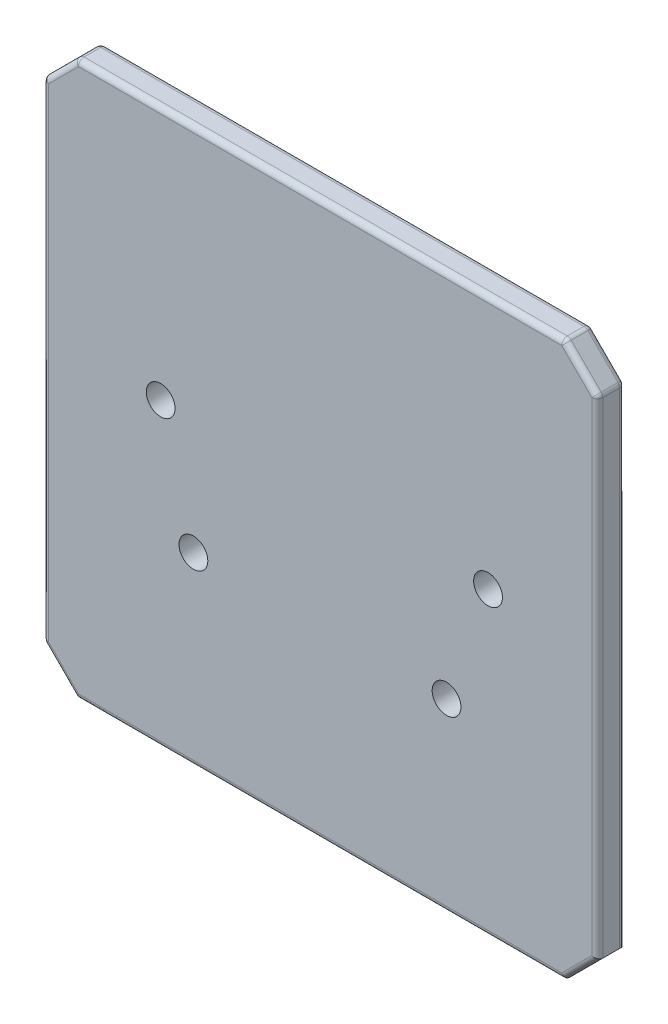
SolidWorks part; units mm, degrees
ref_plane "Front Plane" through (0, 0, 0) normal (0, 0, 1) x (1, 0, 0)
ref_plane "Top Plane" through (0, 0, 0) normal (0, 1, 0) x (1, 0, 0)
ref_plane "Right Plane" through (0, 0, 0) normal (1, 0, 0) x (0, 0, -1)
sketch "Sketch1" plane through (0, 0, 0) normal (0, 0, 1) x (1, 0, 0)
  line L0 (0, 0) -> (0, 43.3571) construction
  line L1 (0, 0) -> (36.8384, 0) construction
  line L2 (36.8384, 0) -> (-32.8968, 0) construction
  line L3 (-63.5, -63.5) -> (-63.5, 63.5)
  line L4 (-63.5, 63.5) -> (63.5, 63.5)
  line L5 (63.5, -63.5) -> (63.5, 63.5)
  line L6 (-63.5, -63.5) -> (63.5, -63.5)
  point P10 (0, 63.5)
  point P11 (63.5, 0)
  point P12 (-63.5, 0)
  dimension "D1" = 127
  dimension "D2" = 127
extrude "Extrude2" add sketch "Sketch1" along normal blind 6.35
chamfer "Chamfer1" distance 7.62 angle 45 4 edges at (-63.5, -63.5, 3.175) (63.5, -63.5, 3.175) (63.5, 63.5, 3.175) (-63.5, 63.5, 3.175)
fillet "Fillet2" radius 1.27 17 edges at (59.69, 59.69, 0) (63.5, 55.88, 3.175) (59.69, 59.69, 6.35) (-55.88, 63.5, 3.175) (0, 63.5, 0) (55.88, 63.5, 3.175) (0, 63.5, 6.35) (-63.5, 0, 0) (-63.5, -55.88, 3.175) (-59.69, -59.69, 0) (0, -63.5, 0) (63.5, 0, 0) (63.5, 0, 6.35) (59.69, -59.69, 6.35) (0, -63.5, 6.35) (-59.69, -59.69, 6.35) (-63.5, 0, 6.35)
fillet "Fillet3" radius 1.27 7 edges at (-55.84, 63.4033, 5.566) (-59.69, 59.69, 6.35) (-63.128, 56.252, 5.978) (-63.5, 55.88, 3.175) (-63.128, 56.252, 0.372) (-55.84, 63.4033, 0.784) (-59.69, 59.69, 0)
sketch "Sketch3" plane through (0, 0, 6.35) normal (0, 0, 1) x (1, 0, 0)
  circle A4 centre (-29.0368, -21.0469) radius 3.3
  circle A5 centre (28.9632, -21.0469) radius 3.3
  circle A6 centre (38.4632, 5.4524) radius 3.3
  circle A7 centre (-36.5368, 5.4524) radius 3.3
extrude "Cut-Extrude1" cut sketch "Sketch3" against normal through all
